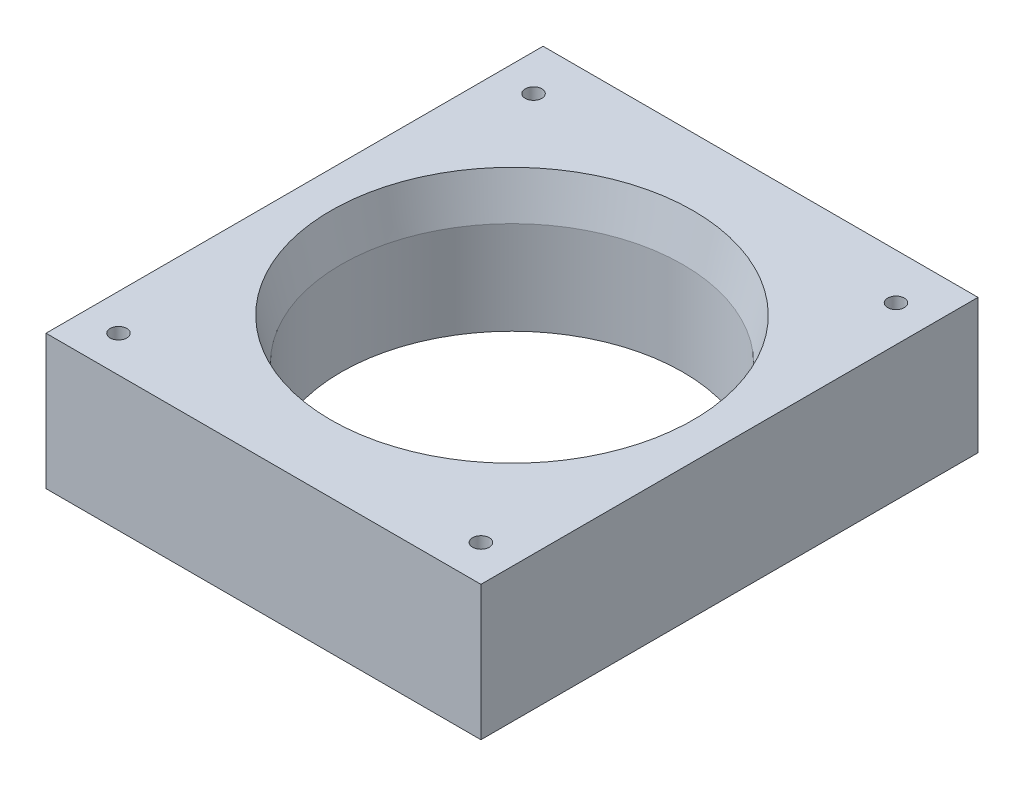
SolidWorks part; units mm, degrees
ref_plane "Front Plane" through (0, 0, 0) normal (0, 0, 1) x (1, 0, 0)
ref_plane "Top Plane" through (0, 0, 0) normal (0, 1, 0) x (1, 0, 0)
ref_plane "Right Plane" through (0, 0, 0) normal (1, 0, 0) x (0, 0, -1)
sketch "Sketch1" plane through (0, -44.577, 0) normal (0, -1, 0) x (-1, 0, 0)
  line L0 (76.2, 261.9375) -> (76.2, -82.1086) construction
  line L1 (9.525, 266.7) -> (142.875, 266.7)
  line L2 (9.525, 266.7) -> (9.525, 419.1)
  line L3 (9.525, 419.1) -> (142.875, 419.1)
  line L4 (142.875, 266.7) -> (142.875, 419.1)
  line L5 (9.525, 266.7) -> (142.875, 419.1) construction
  line L6 (9.525, 419.1) -> (142.875, 266.7) construction
  line L7 (5.7625, 261.9375) -> (146.6375, 261.9375) construction
  line L8 (5.7625, 261.9375) -> (146.6375, 261.9375) construction
  point P0 (76.2, 342.9)
  dimension "D1" = 152.4
  dimension "D2" = 4.7625
  dimension "D3" = 133.35
extrude "Boss-Extrude1" add sketch "Sketch1" against normal blind 41.275
sketch "Sketch2" plane through (0, -3.302, 0) normal (0, 1, 0) x (1, 0, 0)
  circle A0 centre (-76.2, 342.9) radius 52.3875
  dimension "D1" = 104.775
extrude "Cut-Extrude1" cut sketch "Sketch2" against normal through all
sketch "Sketch3" plane through (0, -44.577, 0) normal (0, -1, 0) x (1, 0, 0)
  line L1 (-131.7625, -277.8125) -> (-20.6375, -277.8125)
  line L2 (-131.7625, -277.8125) -> (-131.7625, -405.0665)
  line L3 (-131.7625, -405.0665) -> (-20.6375, -405.0665)
  line L4 (-20.6375, -277.8125) -> (-20.6375, -405.0665)
  line L5 (-131.7625, -277.8125) -> (-20.6375, -405.0665) construction
  line L6 (-131.7625, -405.0665) -> (-20.6375, -277.8125) construction
  point P0 (-76.2, -341.4395)
hole_wizard "1/4-20 Tapped Hole1" positions "Sketch5" profile "Sketch4" tap size "1/4-20" standard "ANSI Inch"
sketch "Sketch5" plane through (0, -44.577, 0) normal (0, -1, 0) x (-1, 0, 0)
  point P0 (20.6375, 277.8125)
  point P3 (131.7625, 277.8125)
  point P6 (131.7625, 405.0665)
  point P9 (20.6375, 405.0665)
sketch "Sketch4" plane through (-20.6375, -44.577, -277.8125) normal (1, 0, 0) x (0, 0, -1)
  line L0 (0, 0) -> (0, 41.275)
  line L1 (0, 41.275) -> (2.5527, 41.275)
  line L2 (2.5527, 41.275) -> (2.5527, 0)
  line L5 (2.5527, 0) -> (0, 0)
  line L11 (0, -6.35) -> (0, 107.95) construction
  dimension "Thru Tap Drill Dia." = 5.1054
  dimension "Thru Tap Drill Depth" = 41.275
chamfer "Chamfer1" distance 3.175 distance2 12.7 1 edges at (-76.2, -3.302, -290.5125)
